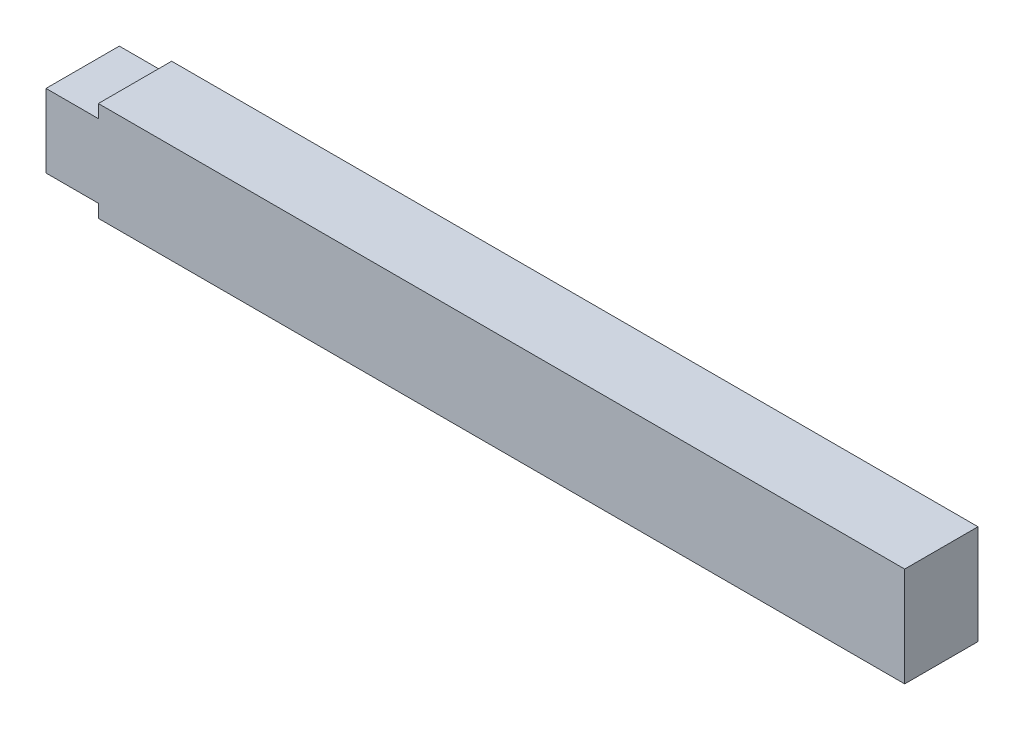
SolidWorks part; units mm, degrees
ref_plane "Plane1"
ref_plane "Plane2" through (0, 0, 0) normal (0, 1, 0) x (1, 0, 0)
ref_plane "Plane3" through (0, 0, 0) normal (1, 0, 0) x (0, 0, -1)
sketch "Sketch1" plane through (0, 0, 0) normal (0, 0, 1) x (1, 0, 0)
  line L0 (0, 50) -> (-100, 50)
  line L1 (-100, 50) -> (-100, -50)
  line L2 (-100, -50) -> (0, -50)
  line L3 (0, 50) -> (0, 75)
  line L4 (0, -50) -> (0, -75)
  line L5 (0, 75) -> (1500, 75)
  line L6 (1500, 75) -> (1500, -75)
  line L7 (1500, -75) -> (0, -75)
  dimension "D1" = 1500
  dimension "D2" = 50
  dimension "D3" = 75
  dimension "D4" = 50
  dimension "D5" = 75
extrude "Base-Extrude" add sketch "Sketch1" along normal mid plane 100
shell "Shell1" thickness 20
